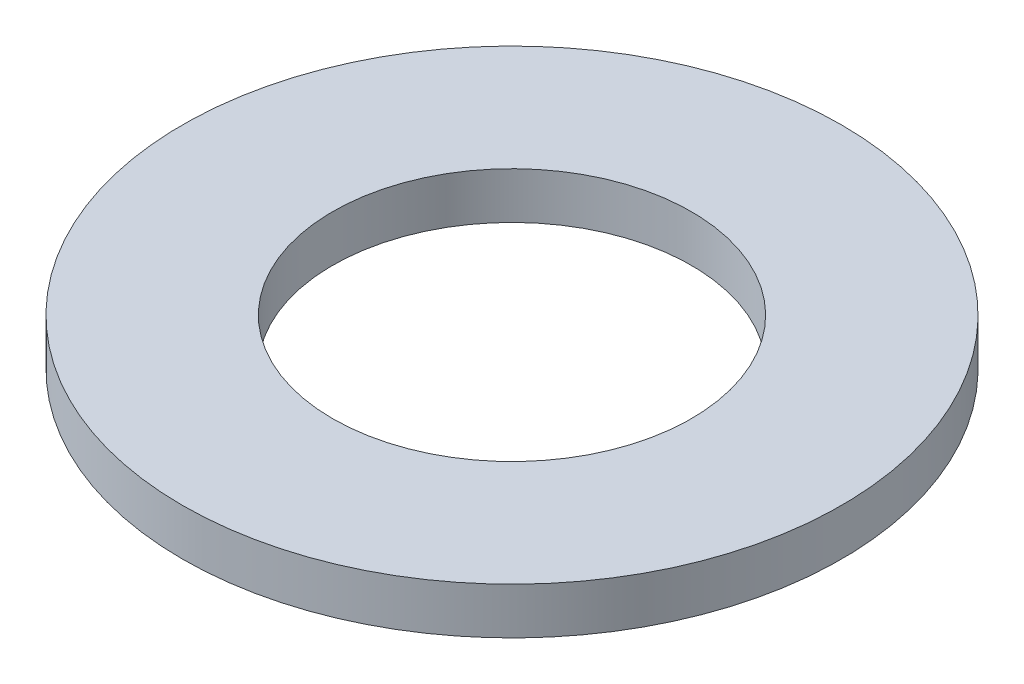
SolidWorks part; units mm, degrees
ref_plane "Front Plane" through (0, 0, 0) normal (0, 0, 1) x (1, 0, 0)
ref_plane "Top Plane" through (0, 0, 0) normal (0, 1, 0) x (1, 0, 0)
ref_plane "Right Plane" through (0, 0, 0) normal (1, 0, 0) x (0, 0, -1)
sketch "Sketch1" plane through (0, 0, 0) normal (0, 1, 0) x (1, 0, 0)
  circle A0 centre (0, 0) radius 13.4874
  dimension "OD" = 26.9748
extrude "Boss-Extrude1" add sketch "Sketch1" along normal blind 1.905
sketch "Sketch5" plane through (0, 1.905, 0) normal (0, 1, 0) x (-1, 0, 0)
  circle A0 centre (0, 0) radius 7.3406
  dimension "ID" = 14.6812
extrude "Cut-Extrude1" cut sketch "Sketch5" against normal through all
